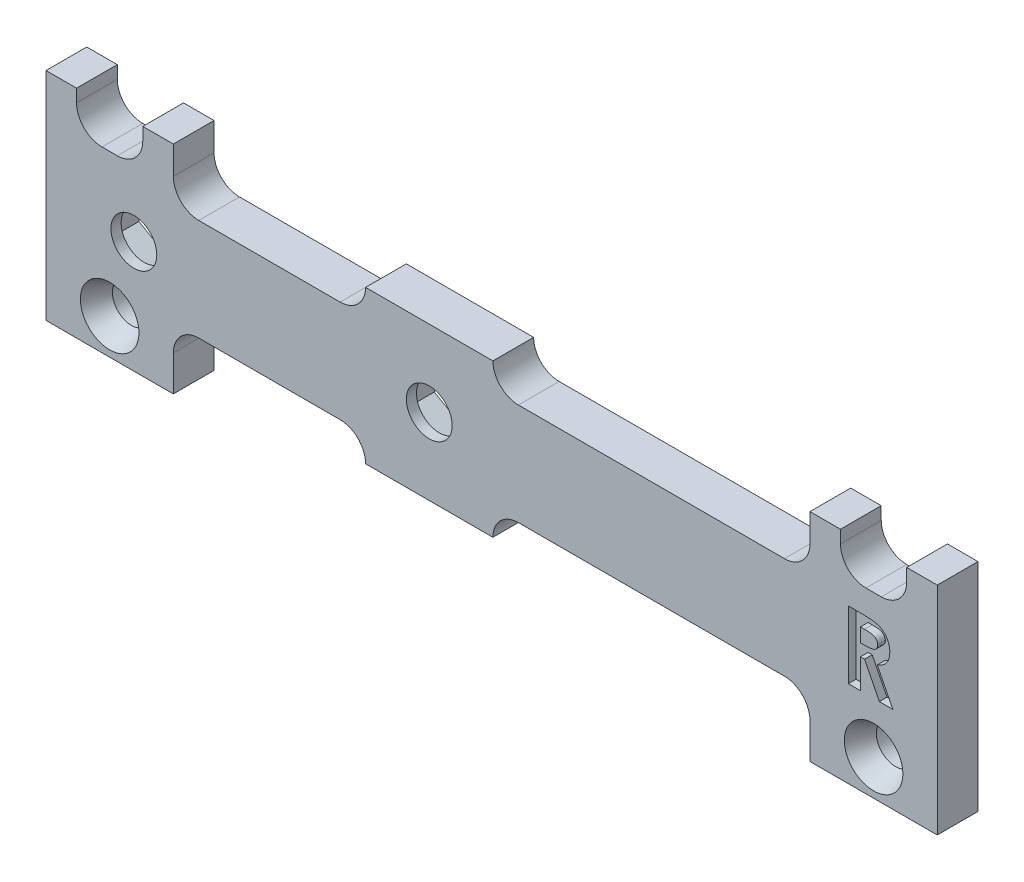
SolidWorks part; units mm, degrees
ref_plane "Front Plane" through (0, 0, 0) normal (0, 0, 1) x (1, 0, 0)
ref_plane "Top Plane" through (0, 0, 0) normal (0, 1, 0) x (1, 0, 0)
ref_plane "Right Plane" through (0, 0, 0) normal (1, 0, 0) x (0, 0, -1)
sketch "Sketch1" plane through (0, 0, 0) normal (0, 0, 1) x (1, 0, 0)
  line L1 (-4.2672, 4.4612) -> (5.7328, 4.4612)
  line L2 (-4.2672, 4.4612) -> (-4.2672, -12.5388)
  line L3 (-4.2672, -12.5388) -> (5.7328, -12.5388)
  line L4 (5.7328, 4.4612) -> (5.7328, -12.5388)
  dimension "D1" = 17
  dimension "D2" = 10
extrude "Boss-Extrude1" add sketch "Sketch1" along normal blind 3.2
sketch "Sketch3" plane through (0, 0, 0) normal (0, 0, 1) x (1, 0, 0)
  line L0 (-4.2672, -12.5388) -> (5.7328, -12.5388) construction
  circle A0 centre (0.7328, -9.7388) radius 1.5
  point P6 (0.7328, -12.5388)
  dimension "D1" = 3
  dimension "D2" = 2.8
extrude "Cut-Extrude3" cut sketch "Sketch3" along normal blind 5.4
ref_plane "Plane1" through (0, 0, 3.2) normal (0, 0, 1) x (1, 0, 0)
sketch "Sketch4" plane through (0, 0, 3.2) normal (0, 0, 1) x (1, 0, 0)
  circle A0 centre (0.7328, -9.7388) radius 2.1
  dimension "D1" = 4.2
sketch "Sketch11" plane through (0, 0, 0) normal (0, 0, 1) x (1, 0, 0)
  line L0 (-4.2672, 4.4612) -> (-4.2672, -12.5388) construction
  line L1 (-4.2672, -12.5388) -> (5.7328, -12.5388) construction
  circle A0 centre (2.6328, -3.7388) radius 1.8
  dimension "D1" = 3.6
  dimension "D2" = 6.9
  dimension "D3" = 8.8
extrude "Cut-Extrude6" cut sketch "Sketch11" along normal up to surface (3.2 mm away)
sketch "Sketch12" plane through (0, 0, 0) normal (0, 0, 1) x (1, 0, 0)
  line L0 (5.7328, -12.5388) -> (5.7328, 4.4612) construction
  line L1 (5.7328, 0.2612) -> (65.7328, 0.2612)
  line L2 (5.7328, 0.2612) -> (5.7328, -7.7388)
  line L3 (5.7328, -7.7388) -> (65.7328, -7.7388)
  line L4 (65.7328, 0.2612) -> (65.7328, -7.7388)
  circle A1 centre (2.6328, -3.7388) radius 1.8 construction
  dimension "D1" = 4
  dimension "D2" = 4
  dimension "D3" = 60
extrude "Boss-Extrude2" add sketch "Sketch12" along normal up to surface (3.2 mm away)
sketch "Sketch13" plane through (0, 0, 0) normal (0, 0, 1) x (1, 0, 0)
  line L0 (65.7328, -7.7388) -> (65.7328, 0.2612) construction
  line L1 (55.7328, -12.5388) -> (65.7328, -12.5388)
  line L2 (55.7328, -12.5388) -> (55.7328, 4.4612)
  line L3 (55.7328, 4.4612) -> (65.7328, 4.4612)
  line L4 (65.7328, -12.5388) -> (65.7328, 4.4612)
  line L5 (5.7328, 4.4612) -> (-4.2672, 4.4612) construction
  line L6 (-4.2672, -12.5388) -> (5.7328, -12.5388) construction
  circle A0 centre (60.7328, -9.7388) radius 1.5
  dimension "D2" = 3
  dimension "D1" = 10
  dimension "D3" = 5
  dimension "D4" = 2.8
extrude "Boss-Extrude3" add sketch "Sketch13" along normal up to surface (3.2 mm away)
sketch "Sketch7" plane through (0, 0, 0) normal (0, 0, 1) x (1, 0, 0)
  line L0 (5.7328, 4.4612) -> (-4.2672, 4.4612) construction
  line L1 (3.3328, 4.4612) -> (-1.8672, 4.4612)
  line L2 (3.3328, 4.4612) -> (3.3328, 1.4612)
  line L3 (3.3328, 1.4612) -> (-1.8672, 1.4612)
  line L4 (-1.8672, 4.4612) -> (-1.8672, 1.4612)
  line L5 (5.7328, -12.5388) -> (5.7328, -7.7388) construction
  line L6 (-4.2672, 4.4612) -> (-4.2672, -12.5388) construction
  line L7 (65.7328, 4.4612) -> (55.7328, 4.4612) construction
  line L8 (58.1328, 4.4612) -> (63.3328, 4.4612)
  line L9 (58.1328, 4.4612) -> (58.1328, 1.4612)
  line L10 (58.1328, 1.4612) -> (63.3328, 1.4612)
  line L11 (63.3328, 4.4612) -> (63.3328, 1.4612)
  line L12 (55.7328, 4.4612) -> (55.7328, 0.2612) construction
  line L13 (65.7328, -12.5388) -> (65.7328, 4.4612) construction
  dimension "D1" = 2.4
  dimension "D2" = 2.4
  dimension "D3" = 3
  dimension "D4" = 2.4
  dimension "D5" = 3
  dimension "D6" = 2.4
extrude "Cut-Extrude7" cut sketch "Sketch7" along normal up to surface (3.2 mm away)
hole_wizard "CSK for M3 Flat Head Machine Screw2" positions "Sketch9" profile "Sketch10" countersink size "M3" standard "ANSI Metric"
sketch "Sketch9" plane through (0, 0, 3.2) normal (0, 0, 1) x (1, 0, 0)
  point P0 (0.7328, -9.7388)
  point P3 (60.7328, -9.7388)
sketch "Sketch10" plane through (0.7328, -9.7388, 3.2) normal (1, 0, 0) x (0, -1, 0)
  line L0 (0, 0) -> (0, 14.9013)
  line L1 (0, 14.9013) -> (1.5, 14)
  line L2 (1.5, 14) -> (1.5, 1.7156)
  line L3 (1.5, 1.7156) -> (2.3, 0)
  line L5 (2.3, 0) -> (0, 0)
  line L6 (-1.5, 1.7156) -> (-2.3, 0) construction
  line L10 (0, 14.9013) -> (-1.5, 14) construction
  line L11 (0, -6.35) -> (0, 107.95) construction
  dimension "Hole Dia." = 3
  dimension "Hole Depth" = 14
  dimension "Near C'Sink Dia." = 4.6
  dimension "Near C'Sink Angle" = 50
  dimension "Drill Angle" = 118
fillet "Fillet1" radius 2 8 edges at (55.7328, -7.7388, 1.6) (5.7328, -7.7388, 1.6) (5.7328, 0.2612, 1.6) (55.7328, 0.2612, 1.6) (63.3328, 1.4612, 1.6) (58.1328, 1.4612, 1.6) (3.3328, 1.4612, 1.6) (-1.8672, 1.4612, 1.6)
sketch "Sketch14" plane through (0, 0, 0) normal (0, 0, 1) x (1, 0, 0)
  line L0 (7.7328, -7.7388) -> (53.7328, -7.7388) construction
  circle A0 centre (25.8328, -3.7388) radius 1.8
  dimension "D1" = 23.2
  dimension "D2" = 3.6
  dimension "D3" = 4
extrude "Cut-Extrude8" cut sketch "Sketch14" along normal up to surface (3.2 mm away)
sketch "Sketch15" plane through (0, 0, 0) normal (0, 0, 1) x (1, 0, 0)
  line L0 (53.7328, 0.2612) -> (7.7328, 0.2612) construction
  line L1 (30.8328, 0.2612) -> (20.8328, 0.2612)
  line L2 (30.8328, 0.2612) -> (30.8328, 2.2612)
  line L3 (30.8328, 2.2612) -> (20.8328, 2.2612)
  line L4 (20.8328, 0.2612) -> (20.8328, 2.2612)
  line L5 (7.7328, -7.7388) -> (53.7328, -7.7388) construction
  line L6 (30.8328, -7.7388) -> (20.8328, -7.7388)
  line L7 (30.8328, -7.7388) -> (30.8328, -9.7388)
  line L8 (30.8328, -9.7388) -> (20.8328, -9.7388)
  line L9 (20.8328, -7.7388) -> (20.8328, -9.7388)
  circle A0 centre (25.8328, -3.7388) radius 1.8 construction
  dimension "D1" = 5
  dimension "D2" = 5
  dimension "D3" = 2
  dimension "D4" = 2
extrude "Boss-Extrude4" add sketch "Sketch15" along normal up to surface (3.2 mm away)
fillet "Fillet2" radius 2 4 edges at (20.8328, -7.7388, 1.6) (30.8328, -7.7388, 1.6) (20.8328, 0.2612, 1.6) (30.8328, 0.2612, 1.6)
ref_plane "Plane2" through (0, 0, 0) normal (0, 0, -1) x (-1, 0, 0)
sketch "Sketch16" plane through (0, 0, 0) normal (0, 0, -1) x (-1, 0, 0)
  line L1 (-2.6328, -0.5056) -> (-5.4328, -2.1222)
  line L2 (-5.4328, -2.1222) -> (-5.4328, -5.3554)
  line L3 (-5.4328, -5.3554) -> (-2.6328, -6.972)
  line L4 (-2.6328, -6.972) -> (0.1672, -5.3554)
  line L5 (0.1672, -5.3554) -> (0.1672, -2.1222)
  line L6 (0.1672, -2.1222) -> (-2.6328, -0.5056)
  line L7 (-25.8328, -0.5056) -> (-28.6328, -2.1222)
  line L8 (-28.6328, -2.1222) -> (-28.6328, -5.3554)
  line L9 (-28.6328, -5.3554) -> (-25.8328, -6.972)
  line L10 (-25.8328, -6.972) -> (-23.0328, -5.3554)
  line L11 (-23.0328, -5.3554) -> (-23.0328, -2.1222)
  line L12 (-23.0328, -2.1222) -> (-25.8328, -0.5056)
  circle A0 centre (-2.6328, -3.7388) radius 2.8 construction
  circle A1 centre (-25.8328, -3.7388) radius 2.8 construction
  dimension "D2" = 5.6
  dimension "D1" = 5.6
extrude "Cut-Extrude9" cut sketch "Sketch16" against normal blind 2.4
ref_plane "Plane3" through (0, 0, 0) normal (0, 0, -1) x (-1, 0, 0)
sketch "Sketch17" plane through (0, 0, 0) normal (0, 0, -1) x (-1, 0, 0)
  line L0 (-32.8328, -7.7388) -> (-53.7328, -7.7388) construction
  line L1 (-62.7328, -2.3388) -> (-31.6328, -2.3388)
  line L2 (-62.7328, -2.3388) -> (-62.7328, -5.1388)
  line L3 (-62.7328, -5.1388) -> (-31.6328, -5.1388)
  line L4 (-31.6328, -2.3388) -> (-31.6328, -5.1388)
  line L5 (-20.0328, -2.3388) -> (-8.4328, -2.3388)
  line L6 (-20.0328, -2.3388) -> (-20.0328, -5.1388)
  line L7 (-20.0328, -5.1388) -> (-8.4328, -5.1388)
  line L8 (-8.4328, -2.3388) -> (-8.4328, -5.1388)
  line L9 (-53.7328, 0.2612) -> (-32.8328, 0.2612) construction
  line L10 (-65.7328, -12.5388) -> (-65.7328, 4.4612) construction
  line L11 (-28.6328, -2.1222) -> (-28.6328, -5.3554) construction
  line L12 (-23.0328, -5.3554) -> (-23.0328, -2.1222) construction
  line L13 (-5.4328, -2.1222) -> (-5.4328, -5.3554) construction
  line L14 (-7.7328, -7.7388) -> (-18.8328, -7.7388) construction
  line L15 (-18.8328, 0.2612) -> (-7.7328, 0.2612) construction
  dimension "D1" = 2.6
  dimension "D2" = 2.6
  dimension "D3" = 3
  dimension "D4" = 3
  dimension "D5" = 3
  dimension "D6" = 3
  dimension "D7" = 2.6
  dimension "D8" = 2.6
extrude "Cut-Extrude10" cut sketch "Sketch17" against normal blind 1.8
ref_plane "Plane4" through (0, 0, 3.2) normal (0, 0, 1) x (1, 0, 0)
sketch "Sketch18" plane through (0, 0, 3.2) normal (0, 0, 1) x (1, 0, 0)
  line L0 (62.4128, -5.7388) -> (52.4128, -5.7388) construction
  line L1 (32.8328, -7.7388) -> (53.7328, -7.7388) construction
  text T0 "R" font "Century Gothic" height in points 20
  dimension "D1" = 2
  dimension "D2" = 10
extrude "Cut-Extrude11" cut sketch "Sketch18" against normal blind 0.6
